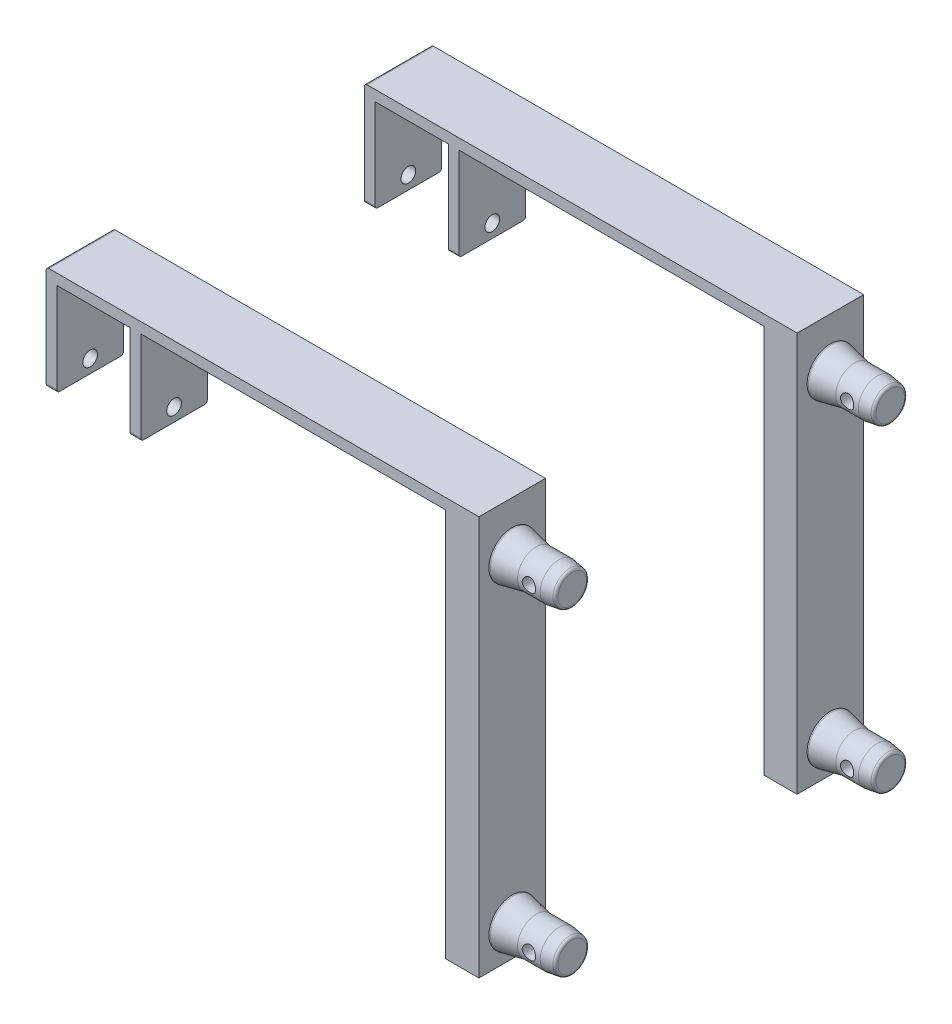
SolidWorks part; units mm, degrees
ref_plane "Face" through (0, 0, 0) normal (0, 0, 1) x (1, 0, 0)
ref_plane "Dessus" through (0, 0, 0) normal (0, 1, 0) x (1, 0, 0)
ref_plane "Droite" through (0, 0, 0) normal (1, 0, 0) x (0, 0, -1)
sketch "Esquisse1" plane through (0, 0, 0) normal (0, 0, 1) x (1, 0, 0)
  line L0 (0, 0) -> (0, 78)
  line L1 (0, 78) -> (325, 78)
  line L2 (325, 78) -> (325, 70)
  line L3 (325, 70) -> (71, 70)
  line L4 (71, 70) -> (71, 0)
  line L5 (71, 0) -> (63, 0)
  line L6 (63, 0) -> (63, 70)
  line L7 (63, 70) -> (8, 70)
  line L8 (8, 70) -> (8, 0)
  line L9 (8, 0) -> (0, 0)
  dimension "D1" = 325
  dimension "D2" = 254
  dimension "D3" = 8
  dimension "D4" = 8
  dimension "D5" = 78
  dimension "D6" = 8
extrude "Extrusion1" add sketch "Esquisse1" along normal blind 50
sketch "Esquisse2" plane through (0, 70, 0) normal (0, -1, 0) x (1, 0, 0)
  line L0 (300, 50) -> (325, 50)
  line L1 (71, 50) -> (325, 50) construction
  line L2 (325, 50) -> (325, 0)
  line L3 (325, 0) -> (300, 0)
  line L4 (71, 0) -> (325, 0) construction
  line L5 (300, 0) -> (300, 5)
  line L6 (300, 5) -> (320, 5)
  line L7 (320, 5) -> (320, 45)
  line L8 (320, 45) -> (300, 45)
  line L9 (300, 45) -> (300, 50)
  dimension "D1" = 25
  dimension "D2" = 5
  dimension "D3" = 5
extrude "Extrusion2" add sketch "Esquisse2" along normal blind 292
sketch "Esquisse3" plane through (325, 0, 0) normal (1, 0, 0) x (0, 0, -1)
  line L0 (0, -222) -> (0, 78) construction
  line L1 (0, -222) -> (-50, -222) construction
  circle A0 centre (-25, 41) radius 5.5
  circle A1 centre (-25, -198) radius 5.5
  dimension "D1" = 11
  dimension "D2" = 25
  dimension "D3" = 239
  dimension "D4" = 24
extrude "Enlèv. mat.-Extru.1" cut sketch "Esquisse3" against normal up to next
sketch "Esquisse4" plane through (71, 0, 0) normal (1, 0, 0) x (0, 0, -1)
  line L0 (0, -222) -> (0, 78) construction
  line L1 (-50, 0) -> (0, 0) construction
  circle A0 centre (-25, 10) radius 5.5
  dimension "D2" = 11
  dimension "D1" = 25
  dimension "D3" = 10
extrude "Enlèv. mat.-Extru.2" cut sketch "Esquisse4" against normal through all
fillet "Congé1" radius 2
ref_plane "Plan1" through (0, 0, 25) normal (0, 0, 1) x (1, 0, 0)
sketch "Esquisse5" plane through (0, 0, 25) normal (0, 0, 1) x (1, 0, 0)
  line L0 (278.0621, 41) -> (397.6896, 41) construction
  line L1 (320, 41) -> (325, 41) construction
  line L2 (325, 41) -> (325, 23.5)
  line L3 (325, 23.5) -> (326, 23.5)
  line L4 (326, 23.5) -> (343, 27)
  line L5 (343, 27) -> (360, 27)
  line L6 (360, 27) -> (370, 28.5)
  line L7 (370, 28.5) -> (370, 41)
  line L8 (370, 41) -> (325, 41)
  line L10 (325, -222) -> (325, 78) construction
  dimension "D1" = 17.5
  dimension "D2" = 12.5
  dimension "D3" = 17
  dimension "D4" = 45
  dimension "D5" = 10
  dimension "D6" = 14
  dimension "D7" = 1
revolve "Révolution1" add sketch "Esquisse5" angle 360 about L0
sketch "Esquisse6" plane through (0, 0, 50) normal (0, 0, 1) x (1, 0, 0)
  line L0 (320, 41) -> (325, 41) construction
  line L1 (278.0621, 41) -> (397.6896, 41) construction
  line L2 (360, 55) -> (360, 27) construction
  circle A0 centre (351.5, 41) radius 5
  dimension "D1" = 10
  dimension "D2" = 8.5
extrude "Enlèv. mat.-Extru.3" cut sketch "Esquisse6" against normal through all
fillet "Congé2" radius 2
pattern_linear "Répétition linéaire2" count 2 spacing 239
pattern_linear "Répétition linéaire1" count 2 spacing 239
